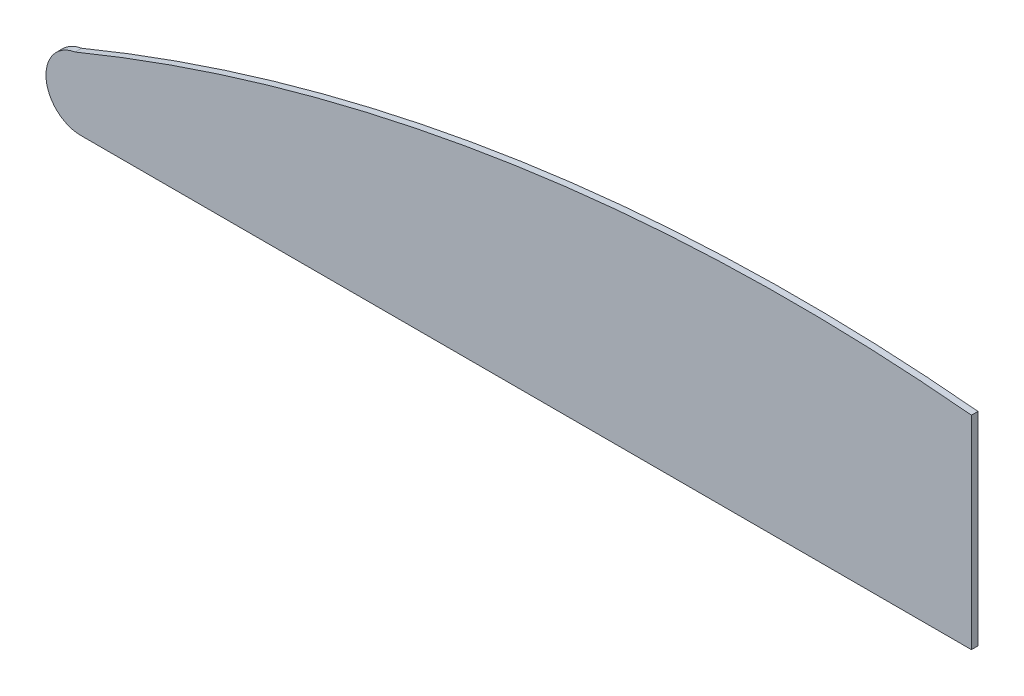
SolidWorks part; units mm, degrees
ref_plane "Front" through (0, 0, 0) normal (0, 0, 1) x (1, 0, 0)
ref_plane "Top" through (0, 0, 0) normal (0, 1, 0) x (1, 0, 0)
ref_plane "Right" through (0, 0, 0) normal (1, 0, 0) x (0, 0, -1)
mirrored part "EndCap_Mirrored"
other "<EndCap>-<Boss-Extrude1>"
